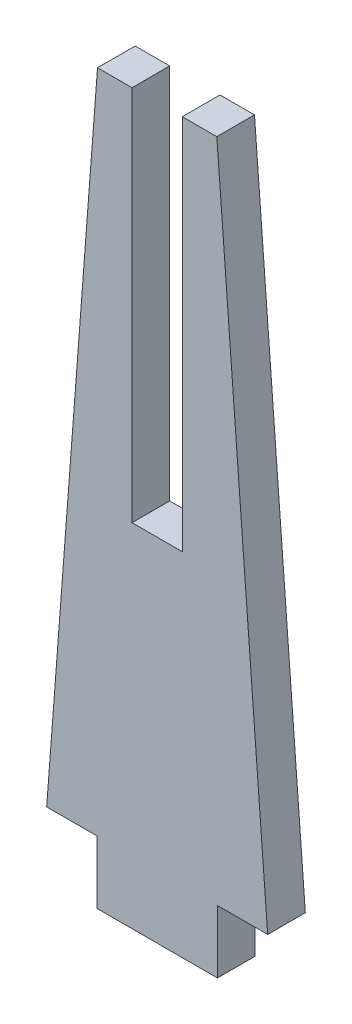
SolidWorks part; units mm, degrees
ref_plane "Alzado" through (0, 0, 0) normal (0, 0, 1) x (1, 0, 0)
ref_plane "Planta" through (0, 0, 0) normal (0, 1, 0) x (1, 0, 0)
ref_plane "Vista lateral" through (0, 0, 0) normal (1, 0, 0) x (0, 0, -1)
sketch "Sketch1" plane through (0, 0, 0) normal (0, 0, 1) x (1, 0, 0)
  line L0 (4.8, 2.5) -> (8.8, 2.5)
  line L1 (-4.8, -2.5) -> (4.8, -2.5)
  line L2 (-4.8, -2.5) -> (-4.8, 2.5)
  line L3 (-4.8, 2.5) -> (4.8, 2.5)
  line L4 (4.8, -2.5) -> (4.8, 2.5)
  line L5 (-4.8, -2.5) -> (4.8, 2.5) construction
  line L6 (-4.8, 2.5) -> (4.8, -2.5) construction
  line L7 (-4.8, 2.5) -> (-8.8, 2.5)
  line L8 (2, 55.5) -> (4.75, 55.5)
  line L9 (-4.75, 55.5) -> (-2, 55.5)
  line L10 (4.75, 55.5) -> (8.8, 2.5)
  line L11 (-4.75, 55.5) -> (-8.8, 2.5)
  line L12 (-2, 25.5) -> (2, 25.5)
  line L13 (-2, 25.5) -> (-2, 55.5)
  line L14 (2, 25.5) -> (2, 55.5)
  point P0 (0, 0)
  point P13 (0, 55.5)
  point P16 (0, 25.5)
  dimension "D1" = 9.6
  dimension "D2" = 5
  dimension "D3" = 4
  dimension "D4" = 4
  dimension "D5" = 53
  dimension "D6" = 9.5
  dimension "D7" = 9.4724
  dimension "D8" = 30
  dimension "D9" = 4
  dimension "D10" = 54.0892
extrude "Boss-Extrude1" add sketch "Sketch1" along normal blind 3 contours L14 L12 L13 L9 L11 L7 L3 L0 L10 L8 | L1 L4 L3 L2
